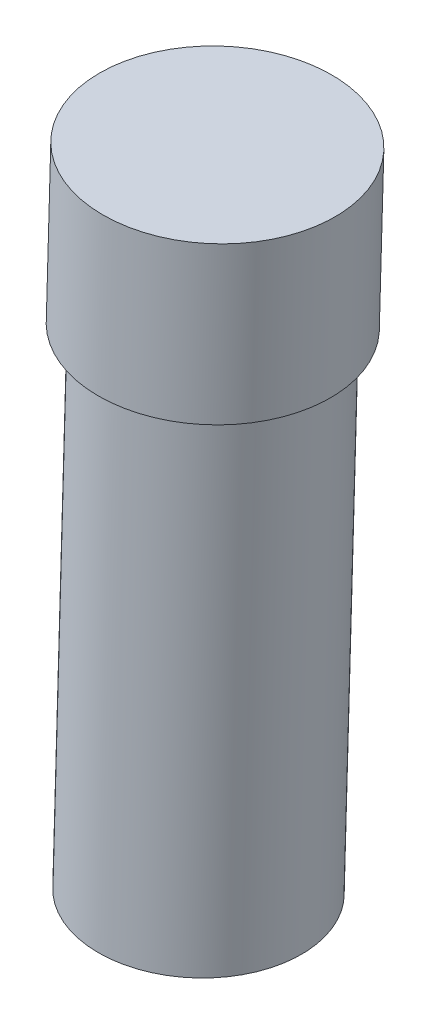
SolidWorks part; units mm, degrees
ref_plane "Plan de face" through (0, 0, 0) normal (0, 0, 1) x (1, 0, 0)
ref_plane "Plan de dessus" through (0, 0, 0) normal (0, 1, 0) x (1, 0, 0)
ref_plane "Plan de droite" through (0, 0, 0) normal (1, 0, 0) x (0, 0, -1)
ref_plane "Plan4" through (0, 0, -134.2213) normal (0, 0, -1) x (-1, 0, 0)
sketch "Esquisse1" plane through (0, 0, -134.2213) normal (0, 0, -1) x (-1, 0, 0)
  line L0 (216.5143, -43.2977) -> (223.5114, -43.0962)
  line L1 (223.5114, -43.0962) -> (222.2293, 1.4439)
  line L2 (222.2293, 1.4439) -> (214.2326, 1.2137)
  line L3 (214.2326, 1.2137) -> (214.5435, -9.5868)
  line L4 (214.5435, -9.5868) -> (215.5431, -9.558)
  line L5 (215.5431, -9.558) -> (216.5143, -43.2977)
  line L6 (223.5172, -43.2975) -> (222.2227, 1.6739) construction
revolve "Révolution1" add sketch "Esquisse1" angle 360 about L6
